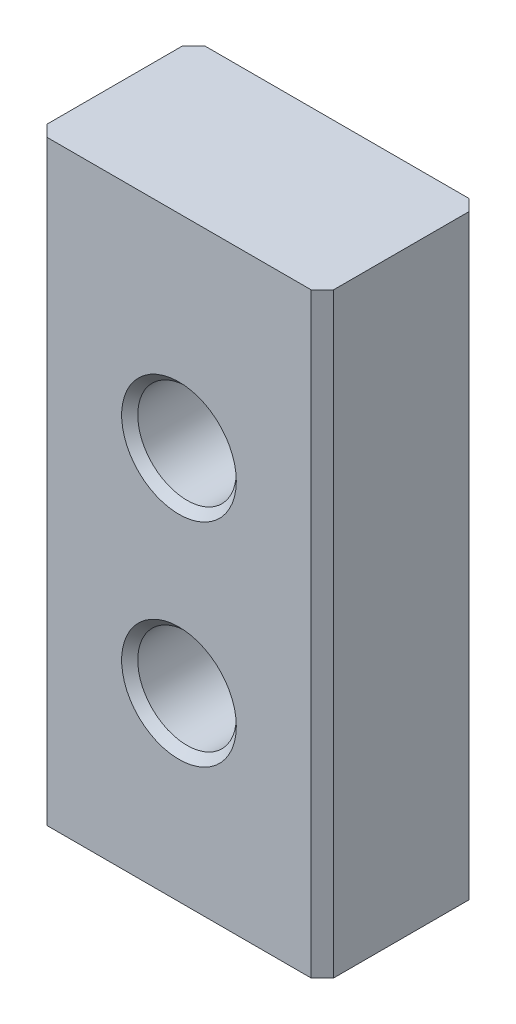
SolidWorks part; units mm, degrees
ref_plane "Front" through (0, 0, 0) normal (0, 0, 1) x (1, 0, 0)
ref_plane "Top" through (0, 0, 0) normal (0, 1, 0) x (1, 0, 0)
ref_plane "Right" through (0, 0, 0) normal (1, 0, 0) x (0, 0, -1)
sketch "Sketch1" plane through (0, 0, 0) normal (0, 0, 1) x (1, 0, 0)
  line L1 (-6.35, 26.4) -> (6.35, 26.4)
  line L2 (-6.35, 26.4) -> (-6.35, 0)
  line L3 (-6.35, 0) -> (6.35, 0)
  line L4 (6.35, 26.4) -> (6.35, 0)
  dimension "D1" = 12.7
  dimension "D2" = 26.4
extrude "Extrude1" add sketch "Sketch1" along normal blind 7
hole_wizard " (0.17188) Diameter Hole1" positions "3DSketch1" profile "Sketch3" hole size "11/64" standard "Ansi Inch"
sketch3d "3DSketch1"
  line L0 (0, 0, 7) -> (0, 8, 7) construction
  line L1 (-6.35, 0, 7) -> (6.35, 0, 7) construction
  point P0 (0, 8, 7)
  point P7 (0, 17.4, 7)
  dimension "D1" = 8
  dimension "D2" = 9.4
sketch "Sketch3" plane through (0, 8, 7) normal (1, 0, 0) x (0, -1, 0)
  line L0 (0, 0) -> (0, 7)
  line L1 (0, 7) -> (2.54, 7)
  line L2 (2.1829, 6.6429) -> (2.1829, 0.3571)
  line L3 (2.1829, 0.3571) -> (2.54, 0)
  line L5 (2.54, 0) -> (0, 0)
  line L6 (-2.1829, 0.3571) -> (-2.54, 0) construction
  line L7 (2.54, 7) -> (2.1829, 6.6429)
  line L8 (-2.54, 7) -> (-2.1829, 6.6429) construction
  line L11 (0, -6.35) -> (0, 107.95) construction
  dimension "Thru Hole Dia." = 4.3658
  dimension "Thru Hole Depth" = 7
  dimension "Near C'Sink Dia." = 5.08
  dimension "Near C'Sink Angle" = 90
  dimension "Far C'Sink Dia." = 5.08
  dimension "Far C'Sink Angle" = 90
sketch "Sketch4" plane through (-6.35, 0, 0) normal (-1, 0, 0) x (0, 0, 1)
  line L1 (7, 26.4) -> (0.65, 26.4)
  line L2 (7, 26.4) -> (7, 33.4)
  line L3 (7, 33.4) -> (0.65, 33.4)
  line L4 (0.65, 26.4) -> (0.65, 33.4)
  dimension "D1" = 7
  dimension "D2" = 6.35
extrude "Extrude2" [suppressed] add sketch "Sketch4" against normal up to surface (12.7 mm away)
sketch "Sketch5" [suppressed] plane through (-6.35, 0, 0) normal (-1, 0, 0) x (0, 0, 1)
  line L1 (0.65, 26.4) -> (2.3, 26.4)
  line L2 (0.65, 26.4) -> (0.65, 28.9)
  line L3 (0.65, 28.9) -> (2.3, 28.9)
  line L4 (2.3, 26.4) -> (2.3, 28.9)
  dimension "D1" = 2.5
  dimension "D2" = 1.65
extrude "Extrude3" [suppressed] cut sketch "Sketch5" against normal up to next
chamfer "Chamfer1" [suppressed] distance 1.65 angle 45
sketch "Sketch6" [suppressed] plane through (0, 0, 0) normal (0, 0, -1) x (-1, 0, 0)
  line L0 (-6.35, 33.4) -> (6.35, 33.4) construction
  line L1 (-6.35, 26.4) -> (-0.6875, 26.4)
  line L2 (-6.35, 26.4) -> (-6.35, 33.4)
  line L3 (-6.35, 33.4) -> (-0.6875, 33.4)
  line L4 (-0.6875, 26.4) -> (-0.6875, 33.4)
  line L6 (6.35, 26.4) -> (5.45, 26.4)
  line L7 (6.35, 26.4) -> (6.35, 33.4)
  line L8 (6.35, 33.4) -> (5.45, 33.4)
  line L9 (5.45, 26.4) -> (5.45, 33.4)
  dimension "D1" = 5.6625
  dimension "D2" = 0.9
extrude "Extrude4" [suppressed] cut sketch "Sketch6" against normal through all
sketch "Sketch7" [suppressed] plane through (0, 0, 0) normal (0, 0, -1) x (-1, 0, 0)
  line L0 (-0.6875, 33.4) -> (5.45, 33.4) construction
  line L1 (-6.35, 26.4) -> (-5.45, 26.4)
  line L2 (-6.35, 26.4) -> (-6.35, 33.4)
  line L3 (-6.35, 33.4) -> (-5.45, 33.4)
  line L4 (-5.45, 26.4) -> (-5.45, 33.4)
  line L5 (6.35, 26.4) -> (0.6875, 26.4)
  line L6 (6.35, 26.4) -> (6.35, 33.4)
  line L7 (6.35, 33.4) -> (0.6875, 33.4)
  line L8 (0.6875, 26.4) -> (0.6875, 33.4)
  dimension "D1" = 0.9
  dimension "D2" = 5.6625
extrude "Extrude5" [suppressed] cut sketch "Sketch7" against normal through all
chamfer "Chamfer2" distance 0.5 angle 45 4 edges at (6.35, 13.2, 0) (-6.35, 13.2, 0) (6.35, 13.2, 7) (-6.35, 13.2, 7)
